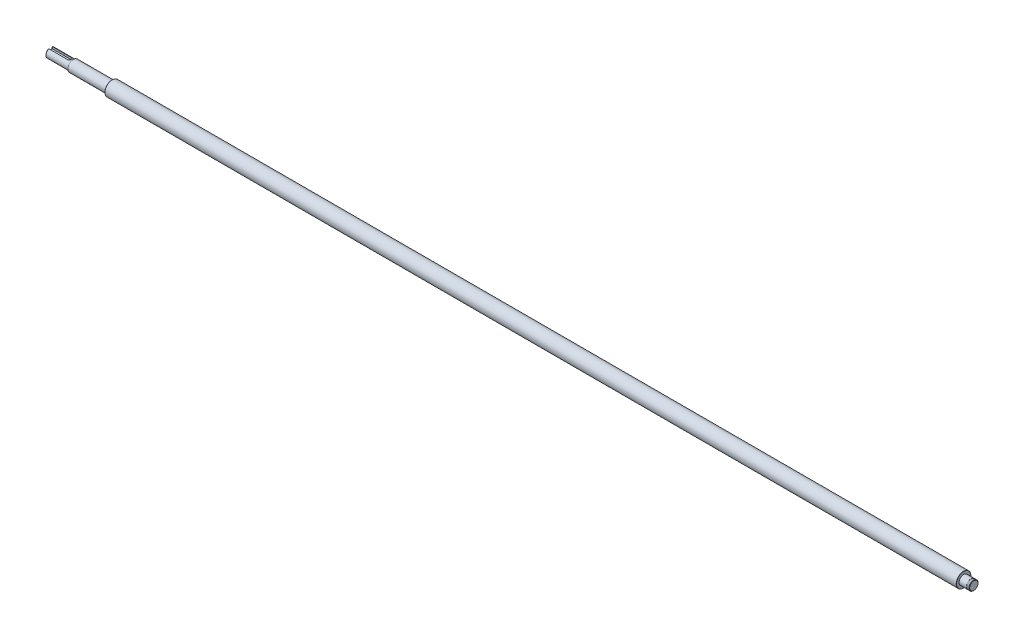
SolidWorks part; units mm, degrees
ref_plane "Front Plane" through (0, 0, 0) normal (0, 0, 1) x (1, 0, 0)
ref_plane "Top Plane" through (0, 0, 0) normal (0, 1, 0) x (1, 0, 0)
ref_plane "Right Plane" through (0, 0, 0) normal (1, 0, 0) x (0, 0, -1)
sketch "Sketch1" plane through (0, 0, 0) normal (0, 0, 1) x (1, 0, 0)
  line L0 (-23.245, 0) -> (-23.245, 5)
  line L1 (-23.245, 5) -> (1.755, 5)
  line L2 (1.755, 5) -> (1.755, 6)
  line L3 (1.755, 6) -> (43.755, 6)
  line L4 (43.755, 6) -> (43.755, 7.9)
  line L5 (43.755, 7.9) -> (965.755, 7.9)
  line L6 (965.755, 7.9) -> (965.755, 5)
  line L7 (965.755, 5) -> (973.755, 5)
  line L8 (973.755, 5) -> (973.755, 4.8)
  line L9 (973.755, 4.8) -> (974.905, 4.8)
  line L10 (974.905, 4.8) -> (974.905, 5)
  line L11 (974.905, 5) -> (976.755, 5)
  line L12 (976.755, 5) -> (976.755, 0)
  line L13 (976.755, 0) -> (-23.245, 0)
  point P3 (43.755, 6.95)
  dimension "D1" = 5
  dimension "D2" = 25
  dimension "D3" = 6
  dimension "D4" = 42
  dimension "D5" = 1000
  dimension "D6" = 11
  dimension "D7" = 5
  dimension "D8" = 4.8
  dimension "D9" = 1.15
  dimension "D10" = 1.85
  dimension "D11" = 7.9
revolve "Revolve1" add sketch "Sketch1" angle 360 about L13
chamfer "Chamfer1" distance 0.5 angle 45 2 edges at (-23.245, 5, 0) (976.755, 5, 0)
chamfer "Chamfer2" distance 0.2 angle 45 3 edges at (965.755, 7.9, 0) (43.755, 7.9, 0) (1.755, 6, 0)
ref_plane "Plane1" through (0, 5, 0) normal (0, 1, 0) x (1, 0, 0)
sketch "Sketch2" plane through (0, 5, 0) normal (0, 1, 0) x (1, 0, 0)
  line L0 (-23.245, 0) -> (-2.245, 0) construction
  line L1 (-23.245, 4.5) -> (-23.245, -4.5) construction
  line L2 (-23.245, 2) -> (-2.245, 2)
  line L3 (-23.245, -2) -> (-2.245, -2)
  arc A0 (-23.245, 2) -> (-23.245, -2) centre (-23.245, 0) ccw
  arc A1 (-2.245, -2) -> (-2.245, 2) centre (-2.245, 0) ccw
  point P5 (-12.745, 0)
  dimension "D1" = 21
  dimension "D2" = 4
extrude "Cut-Extrude1" cut sketch "Sketch2" against normal blind 2.5
